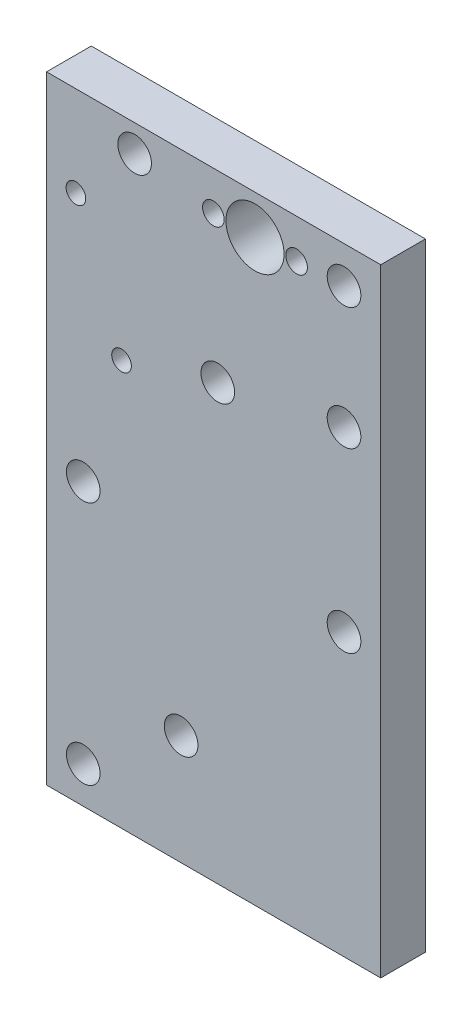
SolidWorks part; units mm, degrees
ref_plane "Front" through (0, 0, 0) normal (0, 0, 1) x (1, 0, 0)
ref_plane "Top" through (0, 0, 0) normal (0, 1, 0) x (1, 0, 0)
ref_plane "Right" through (0, 0, 0) normal (1, 0, 0) x (0, 0, -1)
sketch "Sketch1" plane through (0, 0, 0) normal (0, 0, 1) x (1, 0, 0)
  line L1 (-542.036, 24.13) -> (-455.295, 24.13)
  line L2 (-542.036, 24.13) -> (-542.036, -136.2075)
  line L3 (-542.036, -136.2075) -> (-455.295, -136.2075)
  line L4 (-455.295, 24.13) -> (-455.295, -136.2075)
  line L5 (-538.861, -85.471) -> (-538.861, 85.471) construction
  line L6 (-741.045, 25.4) -> (-455.295, 25.4) construction
  line L7 (-455.295, 25.4) -> (-455.295, 57.15) construction
  point P6 (-542.036, -56.0387)
  dimension "D1" = 1.27
  dimension "D2" = 86.741
  dimension "D3" = 160.3375
  dimension "D4" = 3.175
extrude "Boss-Extrude1" add sketch "Sketch1" along normal blind 11.6082 separate body
hole_wizard "Hole1" positions "Point_Sketch" profile "Profil_Sketch" legacy
sketch "Point_Sketch" plane through (-526.1276, -8.3881, 11.6082) normal (0, 0, -1) x (1, 0, 0)
  point P0 (0.9826, 7.4869)
  point P2 (45.4326, 115.4369)
sketch "Profil_Sketch" plane through (-525.145, -15.875, 11.6082) normal (1, 0, 0) x (0, -1, 0)
  line L0 (0, 0) -> (0, 0.0001)
  line L1 (0, 0.0001) -> (19.4437, 0.0001)
  line L2 (19.4437, 0.0001) -> (19.4437, 0)
  line L4 (19.4437, 0) -> (0, 0)
  line L5 (0, -11.3109) -> (0, 121.1557) construction
  line L6 (0, 0.0001) -> (-19.4437, 0.0001) construction
  dimension "Depth" = 0.0001
  dimension "Drill Angle" = 180
  dimension "Diameter" = 38.8874
other "usin_FP037_DADCO INCH U 0600.025 - 1500 psi<1>"
hole_wizard "Hole11" positions "Point_Sketch1" profile "Profil_Sketch1" tap size "1/4-20" standard "ANSI Inch"
sketch "Point_Sketch1" plane through (-531.9991, 10.2929, 0) normal (0, 0, 1) x (1, 0, 0)
  point P0 (-2.4169, -9.6057)
  point P2 (9.4263, -41.3015)
sketch "Profil_Sketch1" plane through (-534.416, 0.6872, 0) normal (1, 0, 0) x (0, 1, 0)
  line L0 (0, 0) -> (0, 11.6082)
  line L1 (0, 11.6082) -> (2.5527, 11.6082)
  line L2 (2.5527, 11.6082) -> (2.5527, 0)
  line L5 (2.5527, 0) -> (0, 0)
  line L11 (0, -6.35) -> (0, 107.95) construction
  dimension "Thru Tap Drill Dia." = 5.1054
  dimension "Thru Tap Drill Depth" = 11.6082
other "usin_TS230<1>"
hole_wizard "Hole12" positions "Point_Sketch2" profile "Profil_Sketch2" hole size "Ø0.15" standard "ISO"
sketch "Point_Sketch2" plane through (-491.5883, 24.5711, 11.6082) normal (0, 0, -1) x (1, 0, 0)
  point P0 (3.6543, 10.6011)
sketch "Profil_Sketch2" plane through (-487.934, 13.97, 11.6082) normal (1, 0, 0) x (0, -1, 0)
  line L0 (0, 0) -> (0, 11.6082)
  line L1 (0, 11.6082) -> (7.5406, 11.6082)
  line L2 (7.5406, 11.6082) -> (7.5406, 0)
  line L5 (7.5406, 0) -> (0, 0)
  line L11 (0, -6.35) -> (0, 107.95) construction
  dimension "Diameter" = 15.0812
  dimension "Thru Hole Depth" = 11.6082
other "usin_DL090<1>"
hole_wizard "Hole13" positions "Point_Sketch3" profile "Profil_Sketch3" hole size "Ø0.15" standard "ISO"
sketch "Point_Sketch3" plane through (-502.3833, 24.5711, 11.6082) normal (0, 0, -1) x (1, 0, 0)
  point P0 (3.6543, 10.6011)
  point P2 (25.2443, 10.6011)
sketch "Profil_Sketch3" plane through (-498.729, 13.97, 11.6082) normal (1, 0, 0) x (0, -1, 0)
  line L0 (0, 0) -> (0, 11.6082)
  line L1 (0, 11.6082) -> (2.8067, 11.6082)
  line L2 (2.8067, 11.6082) -> (2.8067, 0)
  line L5 (2.8067, 0) -> (0, 0)
  line L11 (0, -6.35) -> (0, 107.95) construction
  dimension "Diameter" = 5.6134
  dimension "Thru Hole Depth" = 11.6082
other "usin_DL090<2>"
hole_wizard "Hole14" positions "Point_Sketch4" profile "Profil_Sketch4" hole size "Ø0.15" standard "ISO"
sketch "Point_Sketch4" plane through (-536.1653, -116.0814, 11.6082) normal (0, 0, -1) x (1, 0, 0)
  point P0 (3.6543, 10.6011)
  point P2 (29.0543, -8.4489)
  point P4 (71.3453, -130.6864)
  point P6 (16.9893, -133.2264)
  point P8 (3.6543, -52.8989)
  point P10 (38.5793, -92.5864)
  point P12 (71.3453, -52.8989)
  point P14 (71.3453, -98.9364)
sketch "Profil_Sketch4" plane through (-532.511, -126.6825, 11.6082) normal (1, 0, 0) x (0, -1, 0)
  line L0 (0, 0) -> (0, 11.6082)
  line L1 (0, 11.6082) -> (4.3688, 11.6082)
  line L2 (4.3688, 11.6082) -> (4.3688, 0)
  line L5 (4.3688, 0) -> (0, 0)
  line L11 (0, -6.35) -> (0, 107.95) construction
  dimension "Diameter" = 8.7376
  dimension "Thru Hole Depth" = 11.6082
other "usin_DL090_.3125-18x1-SHCS<3>"
